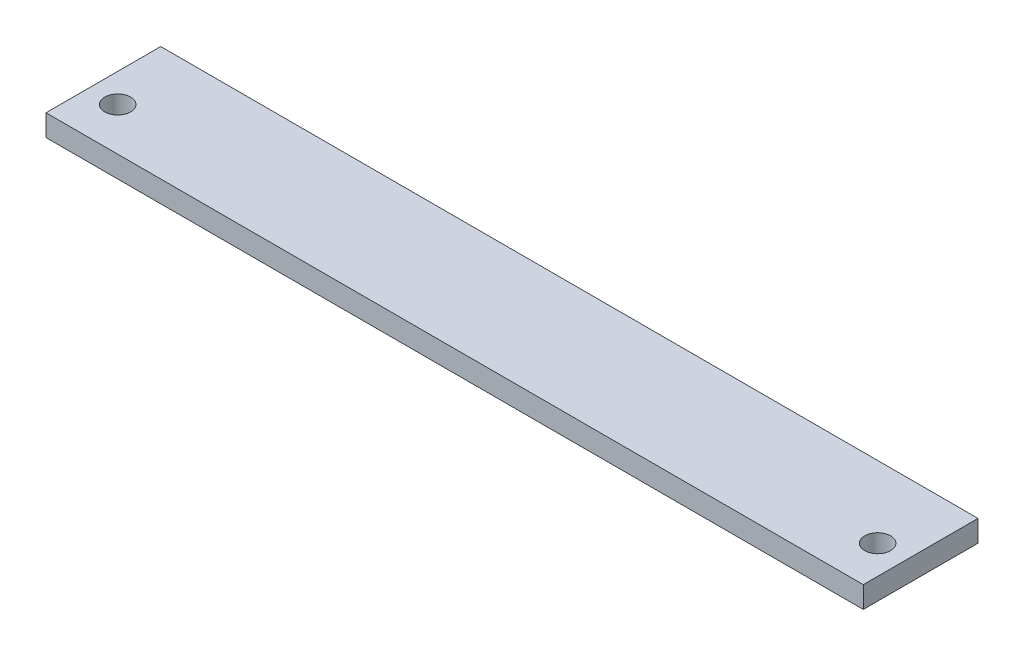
SolidWorks part; units mm, degrees
ref_plane "Front Plane" through (0, 0, 0) normal (0, 0, 1) x (1, 0, 0)
ref_plane "Top Plane" through (0, 0, 0) normal (0, 1, 0) x (1, 0, 0)
ref_plane "Right Plane" through (0, 0, 0) normal (1, 0, 0) x (0, 0, -1)
sketch "Sketch1" plane through (0, 0, 0) normal (0, 1, 0) x (1, 0, 0)
  line L1 (285, -40) -> (-285, -40)
  line L2 (285, -40) -> (285, 40)
  line L3 (285, 40) -> (-285, 40)
  line L4 (-285, -40) -> (-285, 40)
  line L5 (285, -40) -> (-285, 40) construction
  line L6 (285, 40) -> (-285, -40) construction
  point P0 (0, 0)
  dimension "D1" = 80
  dimension "D2" = 570
extrude "Boss-Extrude1" add sketch "Sketch1" along normal blind 15
sketch "Sketch2" plane through (0, 15, 0) normal (0, 1, 0) x (1, 0, 0)
  line L0 (-285, -40) -> (285, -40) construction
  circle A0 centre (-265, -10) radius 9
  dimension "D1" = 18
  dimension "D2" = 30
  dimension "D3" = 20
extrude "Cut-Extrude1" cut sketch "Sketch2" against normal through all contours A0
mirror "Mirror1" about plane through (0, 0, 0) normal (1, 0, 0) of "Cut-Extrude1"
